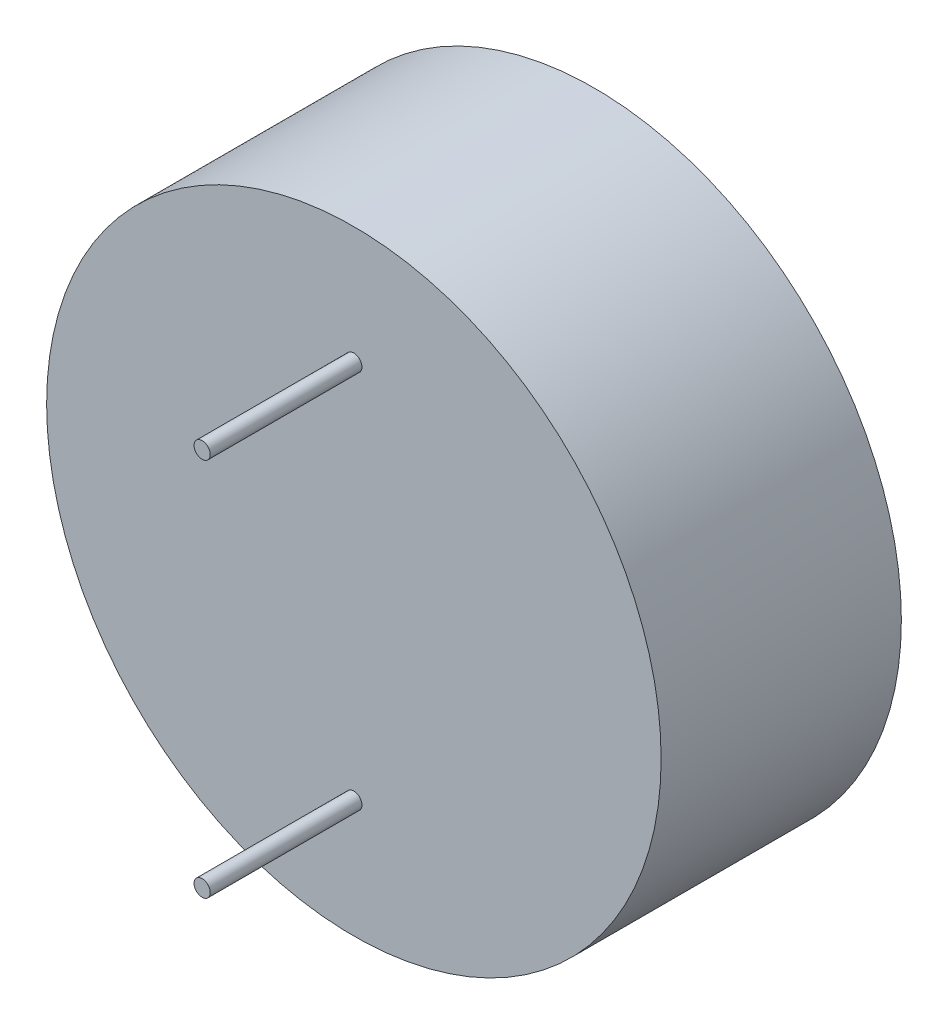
SolidWorks part; units mm, degrees
ref_plane "Plan1" through (0, 0, 0) normal (0, 0, 1) x (1, 0, 0)
ref_plane "Plan2" through (0, 0, 0) normal (0, 1, 0) x (1, 0, 0)
ref_plane "Plan3" through (0, 0, 0) normal (1, 0, 0) x (0, 0, -1)
sketch "Esquisse1" plane through (0, 0, 0) normal (0, 0, 1) x (1, 0, 0)
  circle A0 centre (0, 0) radius 12.15
  dimension "D1" = 24.3
extrude "Base-Extrusion" add sketch "Esquisse1" along normal blind 9.5
sketch "Esquisse2" plane through (0, 0, 0) normal (0, 0, -1) x (-1, 0, 0)
  circle A0 centre (0, 0) radius 1.75
  dimension "D1" = 3.5
extrude "Enlèv. mat.-Extru.1" cut sketch "Esquisse2" against normal blind 4
sketch "Esquisse3" plane through (0, 0, 9.5) normal (0, 0, 1) x (1, 0, 0)
  circle A0 centre (0, 7.5) radius 0.32
  circle A1 centre (0, -7.5) radius 0.32
  dimension "D1" = 0.64
  dimension "D2" = 0.64
  dimension "D3" = 7.5
  dimension "D4" = 7.5
extrude "Boss.-Extru.1" add sketch "Esquisse3" along normal blind 6
